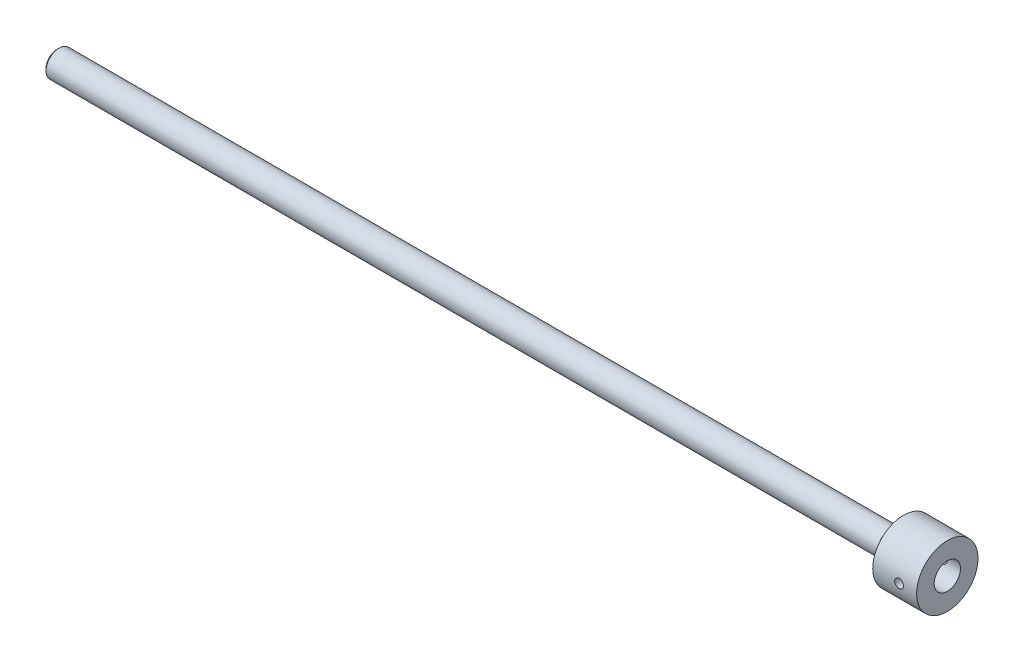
SolidWorks part; units mm, degrees
ref_plane "Plan de face" through (0, 0, 0) normal (0, 0, 1) x (1, 0, 0)
ref_plane "Plan de dessus" through (0, 0, 0) normal (0, 1, 0) x (1, 0, 0)
ref_plane "Plan de droite" through (0, 0, 0) normal (1, 0, 0) x (0, 0, -1)
sketch "Esquisse1" plane through (0, 0, 0) normal (0, 0, 1) x (1, 0, 0)
  line L0 (0, 0) -> (0, 7)
  line L1 (0, 7) -> (-10, 7)
  line L2 (-10, 7) -> (-11.8652, 3)
  line L3 (-12.8652, 3) -> (-202.8652, 3)
  line L4 (-202.8652, 3) -> (-202.8652, 0)
  line L5 (-202.8652, 0) -> (0, 0)
  line L6 (-11.8652, 3) -> (-11.8652, 2.5)
  line L7 (-11.8652, 2.5) -> (-12.8652, 2.5)
  line L8 (-12.8652, 2.5) -> (-12.8652, 3)
  dimension "D1" = 7
  dimension "D2" = 115
  dimension "D3" = 3
  dimension "D4" = 1
  dimension "D5" = 0.5
  dimension "D6" = 190
  dimension "D7" = 10
revolve "Révolution1" add sketch "Esquisse1" angle 360 about L5
chamfer "Chanfrein1" distance 0.5 angle 45 1 edges at (-202.8652, 0, 3)
hole_wizard "Diamètre du perçage Ø6.0 (6)1" positions "Esquisse3" profile "Esquisse2" hole size "Ø6.0" standard "Ansi Métrique"
sketch "Esquisse3" plane through (0, 0, 0) normal (1, 0, 0) x (0, 0, -1)
  point P0 (0, 0)
sketch "Esquisse2" plane through (0, 0, 0) normal (0, 1, 0) x (0, 0, -1)
  line L0 (0, 0) -> (0, 9.8026)
  line L1 (0, 9.8026) -> (3, 8)
  line L2 (3, 8) -> (3, 0)
  line L5 (3, 0) -> (0, 0)
  line L10 (0, 9.8026) -> (-3, 8) construction
  line L11 (0, -6.35) -> (0, 107.95) construction
  dimension "Diamètre du perçage" = 6
  dimension "Profondeur du perçage" = 8
  dimension "Angle de pointe" = 118
sketch "Esquisse4" plane through (0, 0, 0) normal (0, 0, 1) x (1, 0, 0)
  line L0 (0, -7) -> (0, 7) construction
  line L1 (0, 0) -> (-4, 0) construction
  circle A0 centre (-4, 0) radius 1
  dimension "D1" = 2
  dimension "D2" = 4
extrude "Enlèv. mat.-Extru.1" cut sketch "Esquisse4" against normal blind 31 and the other way blind 30
